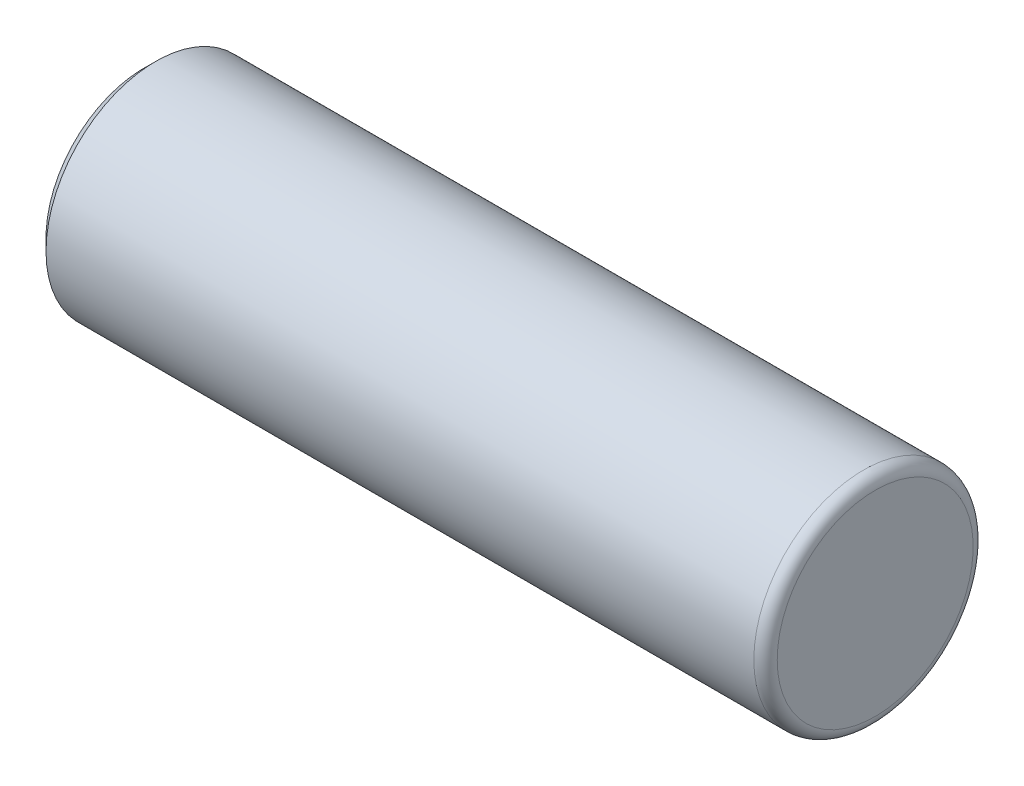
SolidWorks part; units mm, degrees
ref_plane "Front Plane" through (0, 0, 0) normal (0, 0, 1) x (1, 0, 0)
ref_plane "Top Plane" through (0, 0, 0) normal (0, 1, 0) x (1, 0, 0)
ref_plane "Right Plane" through (0, 0, 0) normal (1, 0, 0) x (0, 0, -1)
sketch "Sketch2" plane through (0, 0, 0) normal (0, 0, 1) x (1, 0, 0)
  line L0 (-14.1565, 0) -> (15.3613, 0) construction
  line L1 (-31.75, 0) -> (-31.75, 4.7625)
  line L2 (-31.75, 4.7625) -> (0, 4.7625)
  line L3 (0, 4.7625) -> (0, 0)
  line L4 (0, 0) -> (-31.75, 0)
  dimension "D1" = 9.525
  dimension "D2" = 31.75
revolve "Revolve1" add sketch "Sketch2" angle 360 about L0
chamfer "Chamfer1" distance 0.508 angle 45 1 edges at (-31.75, 0, 4.7625)
fillet "Fillet1" radius 0.508 1 edges at (0, 0, 4.7625)
